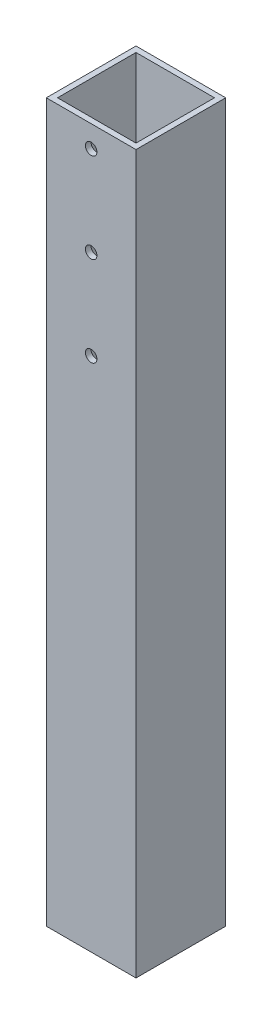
SolidWorks part; units mm, degrees
other "<1_16-Bar-Stock>-<Cut-Extrude1>"
ref_plane "Front Plane" through (0, 0, 0) normal (0, 0, 1) x (1, 0, 0)
ref_plane "Top Plane" through (0, 0, 0) normal (0, 1, 0) x (1, 0, 0)
ref_plane "Right Plane" through (0, 0, 0) normal (1, 0, 0) x (0, 0, -1)
mirrored part "1_16-Bar-Stock_Mirrored"
